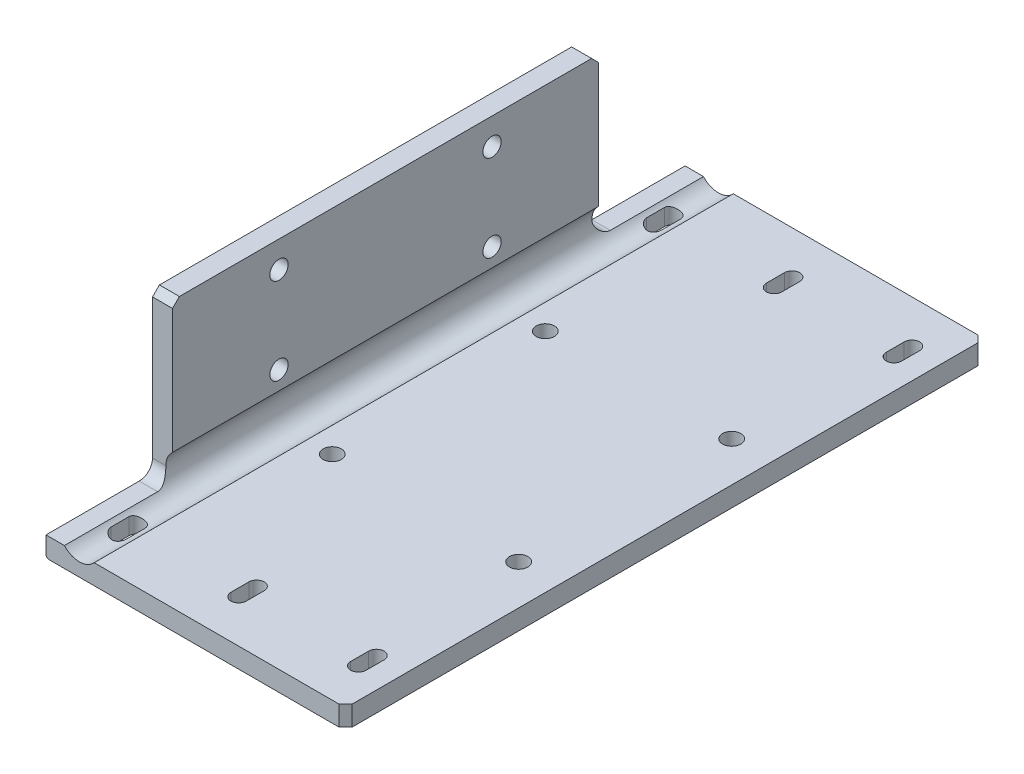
SolidWorks part; units mm, degrees
ref_plane "Front" through (0, 0, 0) normal (0, 0, 1) x (1, 0, 0)
ref_plane "Top" through (0, 0, 0) normal (0, 1, 0) x (1, 0, 0)
ref_plane "Right" through (0, 0, 0) normal (1, 0, 0) x (0, 0, -1)
sketch "Sketch1" plane through (0, 0, 0) normal (0, 0, 1) x (1, 0, 0)
  line L0 (0, 0) -> (0, 142.875)
  line L1 (0, 142.875) -> (-9.525, 142.875)
  line L2 (-9.525, 142.875) -> (-9.525, -9.525)
  line L3 (-9.525, -9.525) -> (142.875, -9.525)
  line L4 (142.875, -9.525) -> (142.875, 0)
  line L5 (142.875, 0) -> (0, 0)
sketch "Sketch2" plane through (0, 0, 0) normal (1, 0, 0) x (0, 0, -1)
  line L0 (-152.4, 0) -> (152.4, 0) construction
  point P2 (0, 0)
  dimension "Length" = 304.8
sketch "Sketch3" plane through (0, 0, 0) normal (0, 0, 1) x (1, 0, 0)
  line L0 (0, 0) -> (0, 142.875) construction
  line L2 (-9.525, 142.875) -> (-9.525, -9.525) construction
  line L3 (-9.525, -9.525) -> (142.875, -9.525) construction
  line L5 (142.875, 0) -> (0, 0) construction
  line L6 (0, 12.7) -> (0, 133.35)
  line L8 (-9.525, 142.875) -> (-9.525, -8.001)
  line L9 (-8.001, -9.525) -> (142.875, -9.525)
  line L11 (133.35, 0) -> (12.7, 0)
  arc A0 (0, 12.7) -> (12.7, 0) centre (12.7, 12.7) ccw
  arc A2 (0, 133.35) -> (-9.525, 142.875) centre (-9.525, 133.35) ccw
  arc A3 (-9.525, -8.001) -> (-8.001, -9.525) centre (-8.001, -8.001) ccw
  arc A4 (142.875, -9.525) -> (133.35, 0) centre (133.35, -9.525) ccw
extrude "Boss-Extrude1" add sketch "Sketch3" along normal up to vertex and the other way up to vertex
sketch "Sketch4" plane through (-9.525, 0, 0) normal (-1, 0, 0) x (0, 0, 1)
  line L0 (152.4, -9.525) -> (-152.4, -9.525) construction
  line L1 (-152.4, 142.875) -> (-101.6, 142.875)
  line L2 (-152.4, 142.875) -> (-152.4, 0)
  line L3 (-152.4, 0) -> (-101.6, 0)
  line L4 (-101.6, 142.875) -> (-101.6, 0)
  line L5 (152.4, 142.875) -> (101.6, 142.875)
  line L6 (152.4, 142.875) -> (152.4, 0)
  line L7 (152.4, 0) -> (101.6, 0)
  line L8 (101.6, 142.875) -> (101.6, 0)
  dimension "D1" = 9.525
  dimension "D2" = 50.8
  dimension "D3" = 50.8
extrude "Cut-Extrude1" cut sketch "Sketch4" against normal through all
sketch "Sketch5" plane through (-9.525, 0, 0) normal (-1, 0, 0) x (0, 0, 1)
  line L0 (19.05, 95.25) -> (101.6, 95.25)
  line L1 (-101.6, 142.875) -> (101.6, 142.875)
  line L2 (-101.6, 142.875) -> (-101.6, 95.25) construction
  line L3 (-101.6, 95.25) -> (-19.05, 95.25)
  line L4 (101.6, 142.875) -> (101.6, 95.25)
  line L5 (0, 142.875) -> (0, 95.25) construction
  arc A0 (-19.05, 95.25) -> (19.05, 95.25) centre (0, 95.25) ccw
  dimension "D2" = 38.1
  dimension "D1" = 47.625
extrude "Cut-Extrude2" cut sketch "Sketch5" against normal through all
sketch "Sketch6" plane through (0, -9.525, 0) normal (0, -1, 0) x (1, 0, 0)
  line L0 (-8.001, -152.4) -> (142.875, -152.4) construction
  line L1 (142.875, 152.4) -> (133.35, 152.4)
  line L2 (142.875, 152.4) -> (142.875, -152.4)
  line L3 (142.875, -152.4) -> (133.35, -152.4)
  line L4 (133.35, 152.4) -> (133.35, -152.4)
  dimension "D1" = 9.525
extrude "Cut-Extrude3" cut sketch "Sketch6" against normal through all
hole_wizard "1/4-20 Tapped Hole1" positions "Sketch7" profile "Sketch9" tap size "1/4-20" standard "ANSI Inch"
sketch "Sketch7" plane through (-9.525, 0, 0) normal (-1, 0, 0) x (0, 0, 1)
  line L1 (-101.6, 0) -> (-101.6, 95.25) construction
  line L2 (101.6, 95.25) -> (101.6, 0) construction
  line L3 (-101.6, 95.25) -> (-19.05, 95.25) construction
  point P0 (-76.2, 69.85)
  point P2 (76.2, 69.85)
  point P4 (76.2, 12.7)
  point P6 (-76.2, 12.7)
  dimension "D1" = 152.4
  dimension "D2" = 57.15
  dimension "D3" = 25.4
  dimension "D4" = 25.4
  dimension "D5" = 25.4
sketch "Sketch9" plane through (-9.525, 69.85, -76.2) normal (0, 1, 0) x (0, 0, 1)
  line L0 (0, 0) -> (0, 142.875)
  line L1 (0, 142.875) -> (2.5527, 142.875)
  line L2 (2.5527, 142.875) -> (2.5527, 1.1049)
  line L3 (2.5527, 1.1049) -> (3.6576, 0)
  line L5 (3.6576, 0) -> (0, 0)
  line L6 (-2.5527, 1.1049) -> (-3.6576, 0) construction
  line L11 (0, -6.35) -> (0, 107.95) construction
  dimension "Thru Tap Drill Dia." = 5.1054
  dimension "Thru Tap Drill Depth" = 142.875
  dimension "Near C'Sink Dia." = 7.3152
  dimension "Near C'Sink Angle" = 90
chamfer "Chamfer1" distance 3.175 angle 45 4 edges at (-4.7625, 95.25, 101.6) (-4.7625, 95.25, -101.6) (133.35, -4.7625, 152.4) (133.35, -4.7625, -152.4)
hole_wizard "1/4 Clearance Slot1" positions "Sketch10" profile "Sketch11" size "1/4" standard "ANSI Inch"
sketch "Sketch10" plane through (0, -9.525, 0) normal (0, -1, 0) x (-1, 0, 0)
  line L0 (-119.0625, 119.7737) -> (-119.0625, 135.6487) construction
  line L1 (8.001, 152.4) -> (-130.175, 152.4) construction
  line L2 (-133.35, 129.99) -> (9.525, 129.99)
  line L3 (-133.35, -149.225) -> (-133.35, 149.225) construction
  line L4 (9.525, -152.4) -> (9.525, 152.4) construction
  line L6 (-61.9125, 129.99) -> (-61.9125, 102.9567)
  point P0 (-119.0625, 127.7112)
  dimension "D1" = 15.875
  dimension "D2" = 24.6888
  dimension "D3" = 142.875
  dimension "D4" = 57.15
sketch "Sketch11" plane through (119.0625, -9.525, -127.7112) normal (1, 0, 0) x (0, 0, -1)
  line L0 (0, 0) -> (0, 104.775)
  line L1 (0, 104.775) -> (3.6576, 104.775)
  line L2 (3.6576, 104.775) -> (3.6576, 0)
  line L5 (3.6576, 0) -> (0, 0)
  line L11 (0, -6.35) -> (0, 107.95) construction
  dimension "Thru Hole Dia." = 7.3152
  dimension "Thru Hole Depth" = 104.775
pattern_linear "LPattern1" count 3 spacing 57.15 along (-1, 0, 0) of "1/4 Clearance Slot1"
mirror "Mirror1" about plane through (0, 0, 0) normal (0, 0, 1) of "LPattern1", "1/4 Clearance Slot1"
sketch "Sketch12" plane through (-9.525, 0, 0) normal (-1, 0, 0) x (0, 0, 1)
  line L0 (-101.6, 0) -> (-101.6, 92.075) construction
  line L1 (-101.6, 76.2) -> (101.6, 76.2)
  line L2 (-101.6, 76.2) -> (-101.6, 95.25)
  line L3 (-101.6, 95.25) -> (101.6, 95.25)
  line L4 (101.6, 76.2) -> (101.6, 95.25)
  line L5 (19.05, 95.25) -> (98.425, 95.25) construction
  line L6 (101.6, 92.075) -> (101.6, 0) construction
  dimension "D1" = 19.05
extrude "Cut-Extrude4" cut sketch "Sketch12" against normal through all
chamfer "Chamfer2" distance 3.302 angle 45 2 edges at (-4.7625, 76.2, -101.6) (-4.7625, 76.2, 101.6)
sketch "Sketch13" plane through (0, 0, 0) normal (0, 0, 1) x (1, 0, 0)
  line L0 (-9.525, 72.898) -> (-9.525, 0) construction
  line L2 (-8.001, -9.525) -> (130.175, -9.525) construction
  circle A0 centre (6.35, 6.35) radius 9.525
  dimension "D1" = 19.05
  dimension "D2" = 15.875
  dimension "D3" = 15.875
extrude "Cut-Extrude5" cut sketch "Sketch13" against normal through all both and the other way through all
sketch "Sketch14" plane through (0, -9.525, 0) normal (0, -1, 0) x (1, 0, 0)
  line L2 (3.175, 69.85) -> (1235.075, 69.85) construction
  line L3 (3.175, -69.85) -> (1235.075, -69.85) construction
hole_wizard "5/16 Clearance Hole1" positions "Sketch15" profile "Sketch16" hole size "5/16" standard "ANSI Inch"
sketch "Sketch15" plane through (0, -9.525, 0) normal (0, -1, 0) x (-1, 0, 0)
  line L0 (-133.35, -149.225) -> (-133.35, 149.225) construction
  point P0 (-25.4, -50.8)
  point P2 (-25.4, 50.8)
  point P4 (-114.3, 50.8)
  point P6 (-114.3, -50.8)
  dimension "D1" = 88.9
  dimension "D2" = 19.05
  dimension "D3" = 50.8
  dimension "D4" = 101.6
sketch "Sketch16" plane through (25.4, -9.525, 50.8) normal (1, 0, 0) x (0, 0, -1)
  line L0 (0, 0) -> (0, 85.725)
  line L1 (0, 85.725) -> (4.365, 85.725)
  line L2 (4.365, 85.725) -> (4.365, 0)
  line L5 (4.365, 0) -> (0, 0)
  line L11 (0, -6.35) -> (0, 107.95) construction
  dimension "Thru Hole Dia." = 8.73
  dimension "Thru Hole Depth" = 85.725
hole_wizard "5/16 Clearance Hole2" positions "Sketch17" profile "Sketch18" hole size "5/16" standard "ANSI Inch"
sketch "Sketch17" plane through (-9.525, 0, 0) normal (-1, 0, 0) x (0, 0, 1)
  line L0 (-98.298, 76.2) -> (98.298, 76.2) construction
  point P0 (-50.8, 63.5)
  point P2 (-50.8, 22.225)
  point P4 (50.8, 22.225)
  point P6 (50.8, 63.5)
  dimension "D1" = 50.8
  dimension "D2" = 101.6
  dimension "D3" = 41.275
  dimension "D4" = 12.7
sketch "Sketch18" plane through (-9.525, 63.5, -50.8) normal (0, 1, 0) x (0, 0, 1)
  line L0 (0, 0) -> (0, 142.875)
  line L1 (0, 142.875) -> (4.365, 142.875)
  line L2 (4.365, 142.875) -> (4.365, 0)
  line L5 (4.365, 0) -> (0, 0)
  line L11 (0, -6.35) -> (0, 107.95) construction
  dimension "Thru Hole Dia." = 8.73
  dimension "Thru Hole Depth" = 142.875
hole_wizard "1/4-20 Tapped Hole2" positions "Sketch21" profile "Sketch22" tap size "1/4-20" standard "ANSI Inch"
sketch "Sketch21" plane through (0, -9.525, 0) normal (0, -1, 0) x (-1, 0, 0)
  line L0 (-133.35, 22.225) -> (-133.35, -22.225) construction
  point P0 (-114.3, 15.875)
  point P2 (-114.3, -15.875)
  dimension "D1" = 15.875
  dimension "D2" = 31.75
  dimension "D3" = 19.05
sketch "Sketch22" plane through (114.3, -9.525, -15.875) normal (1, 0, 0) x (0, 0, -1)
  line L0 (0, 0) -> (0, 104.775)
  line L1 (0, 104.775) -> (2.5527, 104.775)
  line L2 (2.5527, 104.775) -> (2.5527, 1.1049)
  line L3 (2.5527, 1.1049) -> (3.6576, 0)
  line L5 (3.6576, 0) -> (0, 0)
  line L6 (-2.5527, 1.1049) -> (-3.6576, 0) construction
  line L11 (0, -6.35) -> (0, 107.95) construction
  dimension "Thru Tap Drill Dia." = 5.1054
  dimension "Thru Tap Drill Depth" = 104.775
  dimension "Near C'Sink Dia." = 7.3152
  dimension "Near C'Sink Angle" = 90
fillet "Fillet1" radius 6.35 2 edges at (-5.1373, 0, 101.6) (-5.1373, 0, -101.6)
fillet "Fillet2" [suppressed] radius 6.35
equation "\"D2@Sketch3\"=\"Height@Sketch1\"*.01"
